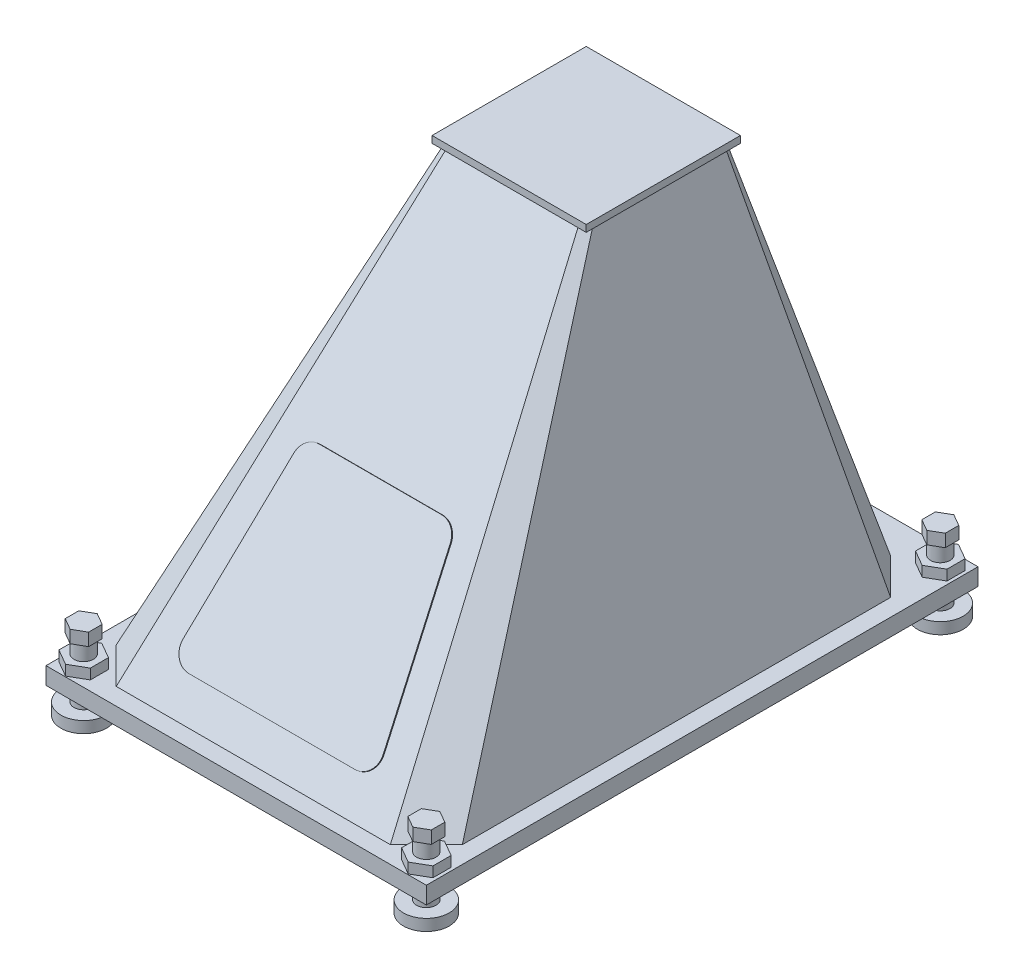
SolidWorks part; units mm, degrees
ref_plane "Ebene vorne" through (0, 0, 0) normal (0, 0, 1) x (1, 0, 0)
ref_plane "Ebene oben" through (0, 0, 0) normal (0, 1, 0) x (1, 0, 0)
ref_plane "Ebene rechts" through (0, 0, 0) normal (1, 0, 0) x (0, 0, -1)
ref_plane "Ebene1" through (0, 682, 0) normal (0, 1, 0) x (1, 0, 0)
sketch "Skizze1" plane through (0, 0, 0) normal (0, 1, 0) x (1, 0, 0)
  line L0 (0, 0) -> (0, 353) construction
  line L1 (-333, 353) -> (333, 353)
  line L2 (-333, 353) -> (-333, -613)
  line L3 (-333, -613) -> (333, -613)
  line L4 (333, 353) -> (333, -613)
  dimension "D1" = 966
  dimension "D2" = 353
  dimension "D3" = 666
extrude "Aufsatz-Linear austragen1" add sketch "Skizze1" along normal blind 30
sketch "Skizze2" plane through (0, 30, 0) normal (0, 1, 0) x (1, 0, 0)
  line L0 (333, 353) -> (-333, 353) construction
  line L1 (-240, 293) -> (240, 293)
  line L2 (-303, 230) -> (-303, -520)
  line L3 (-240, -583) -> (240, -583)
  line L4 (303, 230) -> (303, -520)
  line L5 (-333, 353) -> (-333, -613) construction
  line L6 (-333, -613) -> (333, -613) construction
  line L7 (333, -613) -> (333, 353) construction
  line L8 (-240, 293) -> (-303, 230)
  line L9 (-303, -520) -> (-240, -583)
  line L10 (240, -583) -> (303, -520)
  line L11 (240, 293) -> (303, 230)
  dimension "D1" = 60
  dimension "D2" = 30
  dimension "D3" = 30
  dimension "D4" = 30
  dimension "D5" = 63
sketch "Skizze10" plane through (0, 682, 0) normal (0, 1, 0) x (1, 0, 0)
  line L0 (-115.5, 128) -> (115.5, 128)
  line L1 (115.5, 128) -> (128, 115.5)
  line L2 (128, 115.5) -> (128, -115.5)
  line L3 (128, -115.5) -> (115.5, -128)
  line L4 (115.5, -128) -> (-115.5, -128)
  line L5 (-115.5, -128) -> (-128, -115.5)
  line L6 (-128, -115.5) -> (-128, 115.5)
  line L7 (-128, 115.5) -> (-115.5, 128)
  line L8 (-128, 0) -> (128, 0) construction
  dimension "D1" = 256
  dimension "D2" = 231
loft "Ausformung1" add profiles "Skizze10", "Skizze2"
sketch "Skizze11" plane through (0, 682, 0) normal (0, 1, 0) x (1, 0, 0)
  line L1 (135, -135) -> (-135, -135)
  line L2 (135, -135) -> (135, 135)
  line L3 (135, 135) -> (-135, 135)
  line L4 (-135, -135) -> (-135, 135)
  line L5 (135, -135) -> (-135, 135) construction
  line L6 (135, 135) -> (-135, -135) construction
  point P0 (0, 0)
  dimension "D1" = 270
extrude "Aufsatz-Linear austragen8" add sketch "Skizze11" along normal blind 12
sketch "Skizze6" plane through (0, 0, 0) normal (0, -1, 0) x (1, 0, 0)
  line L0 (-300, 580) -> (300, 580) construction
  line L1 (300, 580) -> (300, -320) construction
  line L2 (300, -320) -> (-300, -320) construction
  line L3 (-300, -320) -> (-300, 580) construction
  line L4 (-333, 613) -> (333, -353) construction
  line L5 (300, 580) -> (-300, -320) construction
  circle A0 centre (-300, 580) radius 17
  circle A1 centre (300, 580) radius 17
  circle A2 centre (300, -320) radius 17
  circle A3 centre (-300, -320) radius 17
  point P12 (0, 130)
  dimension "D2" = 34
  dimension "D1" = 900
  dimension "D3" = 600
extrude "Aufsatz-Linear austragen4" add sketch "Skizze6" along normal blind 25 and the other way blind 75
sketch "Skizze7" plane through (0, 75, 0) normal (0, 1, 0) x (1, 0, 0)
  line L1 (-300, 343.6714) -> (-320.5, 331.8357)
  line L2 (-320.5, 331.8357) -> (-320.5, 308.1643)
  line L3 (-320.5, 308.1643) -> (-300, 296.3286)
  line L4 (-300, 296.3286) -> (-279.5, 308.1643)
  line L5 (-279.5, 308.1643) -> (-279.5, 331.8357)
  line L6 (-279.5, 331.8357) -> (-300, 343.6714)
  line L7 (300, 343.6714) -> (279.5, 331.8357)
  line L8 (279.5, 331.8357) -> (279.5, 308.1643)
  line L9 (279.5, 308.1643) -> (300, 296.3286)
  line L10 (300, 296.3286) -> (320.5, 308.1643)
  line L11 (320.5, 308.1643) -> (320.5, 331.8357)
  line L12 (320.5, 331.8357) -> (300, 343.6714)
  line L13 (300, -556.3286) -> (279.5, -568.1643)
  line L14 (279.5, -568.1643) -> (279.5, -591.8357)
  line L15 (279.5, -591.8357) -> (300, -603.6714)
  line L16 (300, -603.6714) -> (320.5, -591.8357)
  line L17 (320.5, -591.8357) -> (320.5, -568.1643)
  line L18 (320.5, -568.1643) -> (300, -556.3286)
  line L19 (-300, -556.3286) -> (-320.5, -568.1643)
  line L20 (-320.5, -568.1643) -> (-320.5, -591.8357)
  line L21 (-320.5, -591.8357) -> (-300, -603.6714)
  line L22 (-300, -603.6714) -> (-279.5, -591.8357)
  line L23 (-279.5, -591.8357) -> (-279.5, -568.1643)
  line L24 (-279.5, -568.1643) -> (-300, -556.3286)
  circle A0 centre (-300, 320) radius 20.5 construction
  circle A1 centre (300, 320) radius 20.5 construction
  circle A2 centre (300, -580) radius 20.5 construction
  circle A3 centre (-300, -580) radius 20.5 construction
  dimension "D1" = 41
extrude "Aufsatz-Linear austragen5" add sketch "Skizze7" along normal blind 22
sketch "Skizze8" plane through (0, 30, 0) normal (0, 1, 0) x (1, 0, 0)
  line L1 (-300, -611.7543) -> (-272.5, -595.8771)
  line L2 (-272.5, -595.8771) -> (-272.5, -564.1229)
  line L3 (-272.5, -564.1229) -> (-300, -548.2457)
  line L4 (-300, -548.2457) -> (-327.5, -564.1229)
  line L5 (-327.5, -564.1229) -> (-327.5, -595.8771)
  line L6 (-327.5, -595.8771) -> (-300, -611.7543)
  line L7 (300, -611.7543) -> (327.5, -595.8771)
  line L8 (327.5, -595.8771) -> (327.5, -564.1229)
  line L9 (327.5, -564.1229) -> (300, -548.2457)
  line L10 (300, -548.2457) -> (272.5, -564.1229)
  line L11 (272.5, -564.1229) -> (272.5, -595.8771)
  line L12 (272.5, -595.8771) -> (300, -611.7543)
  line L13 (300, 288.2457) -> (327.5, 304.1229)
  line L14 (327.5, 304.1229) -> (327.5, 335.8771)
  line L15 (327.5, 335.8771) -> (300, 351.7543)
  line L16 (300, 351.7543) -> (272.5, 335.8771)
  line L17 (272.5, 335.8771) -> (272.5, 304.1229)
  line L18 (272.5, 304.1229) -> (300, 288.2457)
  line L19 (-300, 288.2457) -> (-272.5, 304.1229)
  line L20 (-272.5, 304.1229) -> (-272.5, 335.8771)
  line L21 (-272.5, 335.8771) -> (-300, 351.7543)
  line L22 (-300, 351.7543) -> (-327.5, 335.8771)
  line L23 (-327.5, 335.8771) -> (-327.5, 304.1229)
  line L24 (-327.5, 304.1229) -> (-300, 288.2457)
  circle A0 centre (-300, -580) radius 27.5 construction
  circle A1 centre (300, -580) radius 27.5 construction
  circle A2 centre (300, 320) radius 27.5 construction
  circle A3 centre (-300, 320) radius 27.5 construction
  dimension "D1" = 55
extrude "Aufsatz-Linear austragen6" add sketch "Skizze8" along normal blind 18
sketch "Skizze9" plane through (0, -25, 0) normal (0, -1, 0) x (1, 0, 0)
  circle A0 centre (-300, 580) radius 40
  circle A1 centre (300, 580) radius 40
  circle A2 centre (300, -320) radius 40
  circle A3 centre (-300, -320) radius 40
  dimension "D1" = 80
extrude "Aufsatz-Linear austragen7" add sketch "Skizze9" along normal offset from surface (20 mm away) 45
sketch "Skizze12" plane through (0, 283.4287, 406.144) normal (0, 0.5723, 0.8201) x (1, 0, 0)
  line L0 (-145.4889, -249.0375) -> (145.4889, -249.0375)
  line L1 (175.197, -214.8623) -> (136.9699, 57.1377)
  line L2 (107.2618, 82.9625) -> (-107.2618, 82.9625)
  line L3 (-136.9699, 57.1377) -> (-175.197, -214.8623)
  line L4 (0, 0) -> (0, 82.9625) construction
  line L5 (-240, -309.0375) -> (240, -309.0375) construction
  arc A0 (145.4889, -249.0375) -> (175.197, -214.8623) centre (145.4889, -219.0375) ccw
  arc A1 (-145.4889, -249.0375) -> (-175.197, -214.8623) centre (-145.4889, -219.0375) cw
  arc A2 (-107.2618, 82.9625) -> (-136.9699, 57.1377) centre (-107.2618, 52.9625) ccw
  arc A3 (136.9699, 57.1377) -> (107.2618, 82.9625) centre (107.2618, 52.9625) ccw
  point P11 (180, -249.0375)
  point P14 (-180, -249.0375)
  dimension "D5" = 30
  dimension "D1" = 360
  dimension "D2" = 16
  dimension "D3" = 332
  dimension "D4" = 60
extrude "Aufsatz-Linear austragen9" add sketch "Skizze12" along normal blind 2
